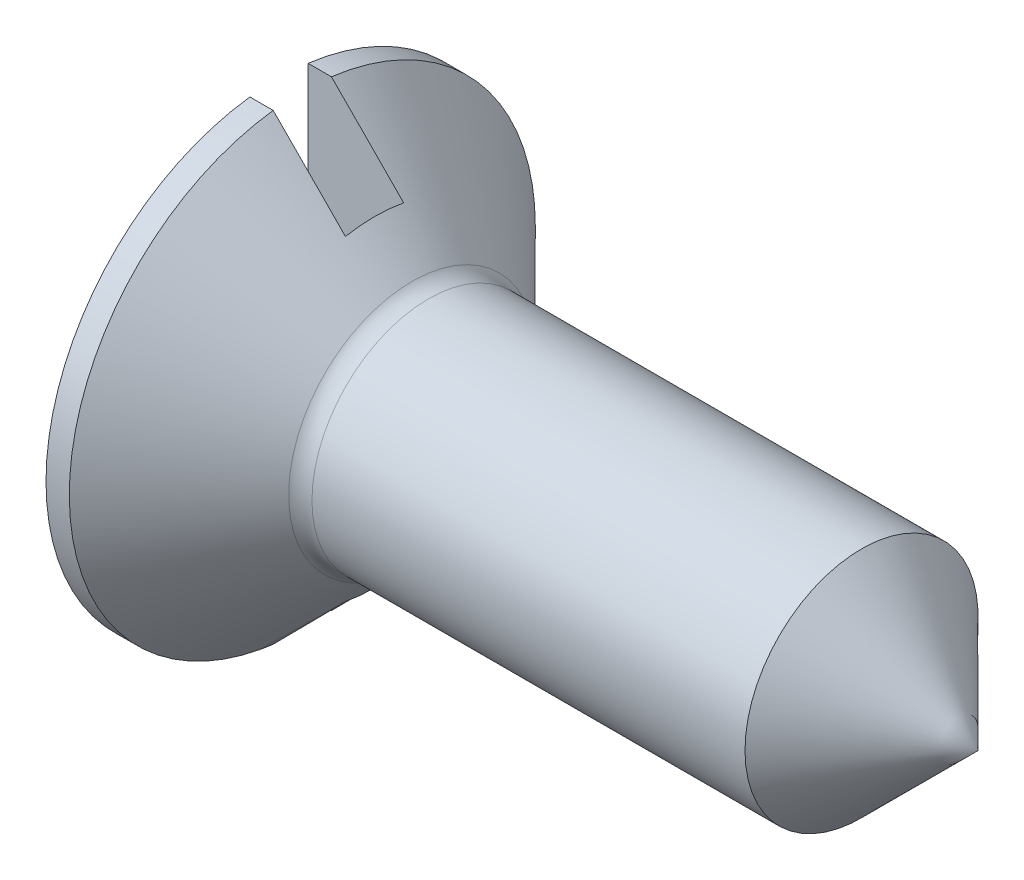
SolidWorks part; units mm, degrees
ref_plane "Front" through (0, 0, 0) normal (0, 0, 1) x (1, 0, 0)
ref_plane "Top" through (0, 0, 0) normal (0, 1, 0) x (1, 0, 0)
ref_plane "Right" through (0, 0, 0) normal (1, 0, 0) x (0, 0, -1)
sketch "Sketch2" plane through (1.6093, 0, 0.5907) normal (0, 1, 0) x (0, 0, -1)
  line L0 (0.5907, -4.3907) -> (0.5907, 1.3247) construction
  line L3 (1.5907, 0.4093) -> (2.7907, 1.6093)
  line L5 (0.5907, 0.4093) -> (1.5907, 0.4093)
  line L6 (2.7907, 1.6093) -> (0.5907, 1.6093)
  line L7 (0.5907, 1.6093) -> (0.5907, 0.4093)
  dimension "D2" = 45
  dimension "k" = 1.2
  dimension "D1" = 1
  dimension "l" = 6
revolve "BaseHead" add sketch "Sketch2" angle 360 about L0
sketch "Sketch1" plane through (1.2, -0.0348, 0.0561) normal (1, 0, 0) x (0, 0, -1)
  circle A0 centre (0.0561, 0.0348) radius 1
  dimension "d" = 2
extrude "BaseBody" add sketch "Sketch1" along normal blind 4.8
sketch "Sketch3" plane through (0, -1.059, 0.7678) normal (-1, 0, 0) x (0, 0, 1)
  circle A0 centre (-0.7678, 1.059) radius 2
  circle A1 centre (-0.7678, 1.059) radius 2.2 construction
  circle A3 centre (-0.7678, 1.059) radius 2.2
  dimension "dk" = 4
extrude "Cut-Extrude1" cut sketch "Sketch3" against normal through all
sketch "Sketch4" plane through (1.4152, 0, -1.4152) normal (0, 1, 0) x (0, 0, -1)
  line L0 (-1.4152, 0.4723) -> (-1.4152, 2.4503) construction
  line L1 (-1.1652, 0.5952) -> (-1.6652, 0.5952)
  line L2 (-1.1652, 0.5952) -> (-1.1652, 1.4152)
  line L3 (-1.1652, 1.4152) -> (-1.6652, 1.4152)
  line L4 (-1.6652, 0.5952) -> (-1.6652, 1.4152)
  line L7 (0.5848, 1.4152) -> (-3.4152, 1.4152) construction
  dimension "n" = 0.5
  dimension "t" = 0.82
extrude "Slot" cut sketch "Sketch4" against normal through all and the other way through all
sketch "Sketch5" plane through (23.6694, -6.3306, 0) normal (0, 0, 1) x (0, 1, 0)
  line L0 (6.3306, -6.6611) -> (6.3306, -3.7572) construction
  line L2 (6.3306, 17.324) -> (36.3306, 17.324)
  line L3 (36.3306, 17.324) -> (36.3306, 47.6694)
  line L4 (36.3306, 47.6694) -> (6.3306, 17.6694)
  line L5 (6.3306, 17.6694) -> (6.3306, 17.324)
  line L7 (5.3306, 17.6694) -> (7.3306, 17.6694) construction
  dimension "D1" = 45
  dimension "D2" = 30
  dimension "D3" = 0.3455
revolve "Cut-Revolve1" cut sketch "Sketch5" angle 360 about L0
fillet "Fillet1" radius 0.2 1 edges at (1.2, 0, -1)
sketch "Sketch6" [suppressed] plane through (0, 0, 0) normal (0, 0, 1) x (1, 0, 0)
  line L0 (3.2, 1.2) -> (3.45, 1.2)
  line L1 (3.45, 1.2) -> (3.45, 1)
  line L2 (3.45, 1) -> (3.325, 0.7835)
  line L3 (3.2, 1) -> (3.325, 0.7835)
  line L4 (3.2, 1.2) -> (3.2, 1)
  line L5 (10.7743, 0) -> (0, 0) construction
  line L6 (3.2, 1) -> (3.45, 1) construction
  line L7 (3.325, 1) -> (3.325, 0.7835) construction
  line L8 (6.2, 1) -> (1.2828, 1) construction
  point P5 (3.325, 1.2)
  dimension "D1" = 0.2
  dimension "D2" = 0.25
  dimension "D3" = 4
revolve "Cut-Revolve10" [suppressed] cut sketch "Sketch6" angle 360 about L5
pattern_linear "LPattern10" [suppressed] count 8 spacing 0.5
equation "\"D1@Sketch2\" = \"d@Sketch1\" / 2"
equation "\"D3@Sketch6\" = \"D1@ThreadCosmetic1\" + \"d@Sketch1\" / 2"
equation "\"D2@Sketch6\" = (  \"d@Sketch1\" - \"D2@ThreadCosmetic1\" )  / 2"
equation "\"D3@LPattern10\" = \"D2@Sketch6\" * 2"
equation "\"D1@LPattern10\" = \"D3@Sketch6\" / \"D3@LPattern10\""
equation "\"l@BaseBody\" = \"l@Sketch2\" - \"k@Sketch2\""
